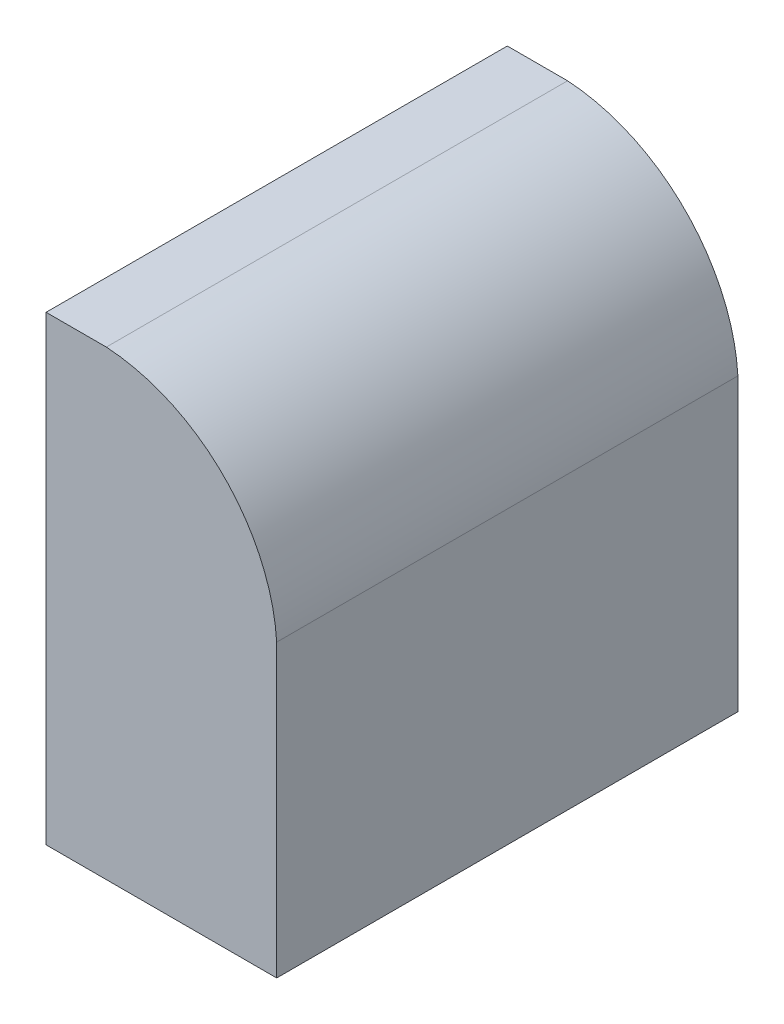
SolidWorks part; units mm, degrees
ref_plane "Front Plane" through (0, 0, 0) normal (0, 0, 1) x (1, 0, 0)
ref_plane "Top Plane" through (0, 0, 0) normal (0, 1, 0) x (1, 0, 0)
ref_plane "Right Plane" through (0, 0, 0) normal (1, 0, 0) x (0, 0, -1)
sketch "Sketch1" plane through (0, 0, 0) normal (0, 0, 1) x (1, 0, 0)
  line L0 (0, 0) -> (12.7, 0)
  line L1 (0, 0) -> (0, 25.4)
  line L2 (12.7, 0) -> (12.7, 16.0185)
  line L3 (3.3185, 25.4) -> (0, 25.4)
  arc A0 (3.3185, 25.4) -> (12.7, 16.0185) centre (2.6901, 15.3901) cw
extrude "Boss-Extrude1" add sketch "Sketch1" along normal blind 25.4
sketch "Sketch2" plane through (0, 0, 0) normal (0, -1, 0) x (1, 0, 0)
  line L0 (0, 25.4) -> (12.7, 12.7) construction
  line L1 (0, 25.4) -> (0, 0) construction
  line L2 (12.7, 25.4) -> (12.7, 0) construction
  line L3 (12.7, 12.7) -> (0, 0) construction
  circle A0 centre (6.35, 19.05) radius 1.8288
  circle A1 centre (6.35, 6.35) radius 1.8288
extrude "Cut-Extrude1" cut sketch "Sketch2" against normal blind 12.7
sketch "Sketch3" plane through (0, 0, 0) normal (-1, 0, 0) x (0, 0, 1)
  line L0 (0, 12.9743) -> (25.4, 12.7) construction
  line L1 (0, 25.4) -> (0, 0) construction
  line L2 (25.4, 25.4) -> (25.4, 0) construction
  line L3 (0, 25.4) -> (12.7, 12.8371) construction
  line L4 (12.7, 12.8371) -> (25.4, 25.4) construction
  line L5 (25.4, 25.4) -> (0, 25.4) construction
  circle A0 centre (6.6093, 18.8621) radius 3.175
  circle A1 centre (19.05, 19.1186) radius 3.175
extrude "Cut-Extrude2" cut sketch "Sketch3" against normal blind 3
